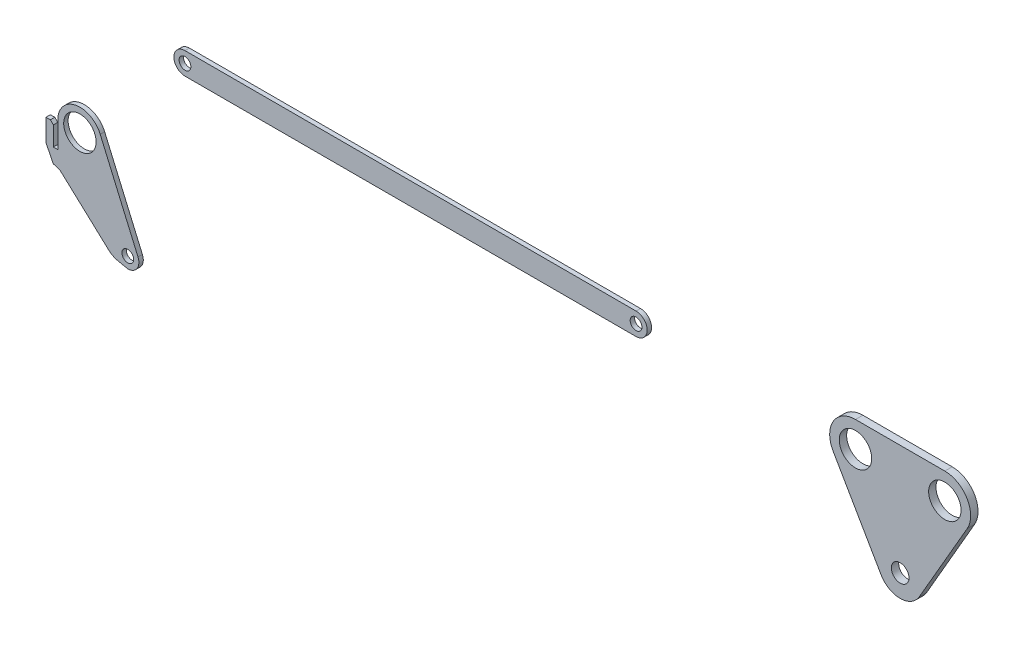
SolidWorks part; units mm, degrees
ref_plane "Front Plane" through (0, 0, 0) normal (0, 0, 1) x (1, 0, 0)
ref_plane "Top Plane" through (0, 0, 0) normal (0, 1, 0) x (1, 0, 0)
ref_plane "Right Plane" through (0, 0, 0) normal (1, 0, 0) x (0, 0, -1)
sketch "Sketch1" plane through (0, 0, 0) normal (0, 0, 1) x (1, 0, 0)
  line L1 (12.9904, -47.5) -> (45.4663, 8.75)
  line L2 (30.3109, 35) -> (-30.3109, 35)
  line L3 (-45.4663, 8.75) -> (-12.9904, -47.5)
  circle A0 centre (0, 0) radius 35 construction
  arc A1 (-12.9904, -47.5) -> (12.9904, -47.5) centre (0, -40) ccw
  arc A2 (45.4663, 8.75) -> (30.3109, 35) centre (30.3109, 17.5) ccw
  arc A3 (-30.3109, 35) -> (-45.4663, 8.75) centre (-30.3109, 17.5) ccw
  circle A4 centre (-30.3109, 17.5) radius 11
  circle A5 centre (30.3109, 17.5) radius 11
  circle A6 centre (0, -40) radius 6
  point P7 (0, 0)
  dimension "D1" = 30
  dimension "D2" = 35
  dimension "D3" = 35
  dimension "D4" = 22
  dimension "D5" = 22
  dimension "D6" = 12
  dimension "D7" = 70
extrude "Boss-Extrude1" add sketch "Sketch1" along normal blind 5
ref_plane "Plane1" through (0, 0, 25) normal (0, 0, 1) x (1, 0, 0)
sketch "Sketch2" plane through (0, 0, 25) normal (0, 0, 1) x (1, 0, 0)
  line L1 (-462.1401, 47.2741) -> (-156.1401, 47.2741)
  line L3 (-462.1401, 32.2741) -> (-156.1401, 32.2741)
  line L5 (-462.1401, 47.2741) -> (-156.1401, 32.2741) construction
  line L6 (-462.1401, 32.2741) -> (-156.1401, 47.2741) construction
  arc A0 (-156.1401, 47.2741) -> (-156.1401, 32.2741) centre (-156.1401, 39.7741) cw
  circle A1 centre (-156.1401, 39.7741) radius 4
  arc A2 (-462.1401, 32.2741) -> (-462.1401, 47.2741) centre (-462.1401, 39.7741) cw
  circle A3 centre (-462.1401, 39.7741) radius 4
  point P0 (-309.1401, 39.7741)
  dimension "D3" = 8
  dimension "D4" = 180
  dimension "D5" = 8
  dimension "D1" = 15
  dimension "D2" = 306
extrude "Boss-Extrude2" add sketch "Sketch2" along normal blind 3 separate body
ref_plane "Plane2" through (0, 0, 50) normal (0, 0, 1) x (1, 0, 0)
sketch "Sketch3" plane through (0, 0, 50) normal (0, 0, 1) x (1, 0, 0)
  line L0 (-508.4128, -11.57) -> (-475.9128, -67.8616) construction
  line L1 (-475.9128, -67.8616) -> (-525.9128, -67.8616) construction
  line L2 (-494.6438, -5.6189) -> (-469.0283, -64.8861)
  line L5 (-508.4128, -11.57) -> (-508.4128, -75.3616) construction
  line L8 (-523.4128, -11.57) -> (-523.4128, -29.0151)
  line L11 (-523.4128, -29.0151) -> (-526.4128, -29.0151)
  line L13 (-526.4128, -39.0151) -> (-525.4128, -39.0151)
  line L15 (-526.4128, -29.0151) -> (-526.4128, -16.0151)
  line L16 (-528.4128, -14.0151) -> (-531.4128, -14.0151)
  line L17 (-531.4128, -14.0151) -> (-531.4128, -29.0151)
  line L18 (-531.4128, -29.0151) -> (-526.4128, -39.0151)
  line L20 (-521.9401, -40.3683) -> (-487.6916, -71.8387)
  line L21 (-484.2619, -73.6039) -> (-475.9128, -75.3616)
  line L22 (-526.4128, -16.0151) -> (-528.4128, -14.0151)
  line L23 (-487.6916, -71.8387) -> (-484.2619, -73.6039)
  line L24 (-525.4128, -39.0151) -> (-521.9401, -40.3683)
  arc A0 (-494.6438, -5.6189) -> (-523.4128, -11.57) centre (-508.4128, -11.57) ccw
  arc A1 (-475.9128, -75.3616) -> (-469.0283, -64.8861) centre (-475.9128, -67.8616) ccw
  circle A2 centre (-508.4128, -11.57) radius 11
  circle A3 centre (-475.9128, -67.8616) radius 4
  point P7 (-523.4128, -39.0151)
  point P8 (0, 0)
  point P10 (-526.4128, -14.0151)
  point P11 (-486.219, -73.1919)
  dimension "D1" = 30
  dimension "D2" = 15
  dimension "D3" = 50
  dimension "D5" = 65
  dimension "D8" = 22
  dimension "D9" = 8
  dimension "D4" = 60
  dimension "D10" = 15
  dimension "D11" = 5
  dimension "D12" = 3
  dimension "D13" = 10
extrude "Boss-Extrude3" add sketch "Sketch3" along normal blind 3 separate body
